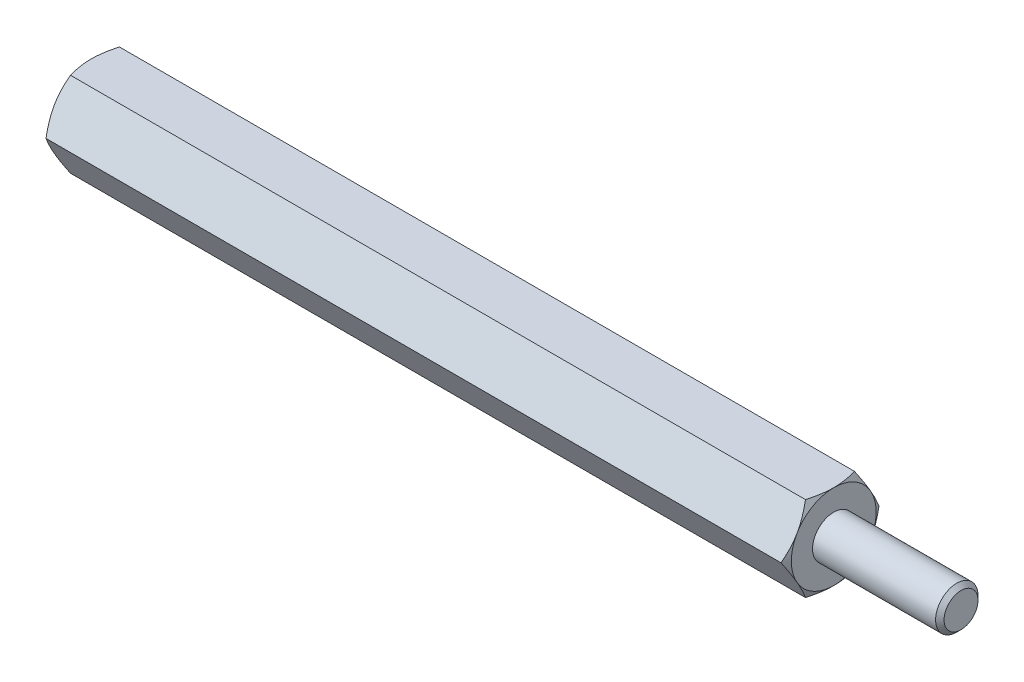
SolidWorks part; units mm, degrees
ref_plane "Front Plane" through (0, 0, 0) normal (0, 0, 1) x (1, 0, 0)
ref_plane "Top Plane" through (0, 0, 0) normal (0, 1, 0) x (1, 0, 0)
ref_plane "Right Plane" through (0, 0, 0) normal (1, 0, 0) x (0, 0, -1)
sketch "Sketch1" plane through (0, 0, 0) normal (1, 0, 0) x (0, 0, -1)
  line L1 (1.1547, 2) -> (-1.1547, 2)
  line L2 (-1.1547, 2) -> (-2.3094, 0)
  line L3 (-2.3094, 0) -> (-1.1547, -2)
  line L4 (-1.1547, -2) -> (1.1547, -2)
  line L5 (1.1547, -2) -> (2.3094, 0)
  line L6 (2.3094, 0) -> (1.1547, 2)
  circle A0 centre (0, 0) radius 2 construction
  dimension "D1" = 4
extrude "Extrude2" add sketch "Sketch1" along normal mid plane 35
sketch "Sketch2" plane through (0, 0, 0) normal (0, 0, 1) x (1, 0, 0)
  line L0 (-17.5, 2) -> (-16, 4.5981)
  line L1 (-17.5, 5) -> (-17.5, 2)
  line L3 (0, 0) -> (50000, 0) construction
  arc A0 (-16, 4.5981) -> (-17.5, 5) centre (-16.6962, 5) ccw
  dimension "D1" = 30
  dimension "D2" = 3
revolve "Cut-Revolve1" cut sketch "Sketch2" angle 360 about L3
mirror "Mirror1" about plane through (0, 0, 0) normal (1, 0, 0) of "Cut-Revolve1"
sketch "Sketch3" plane through (-17.5, 0, 0) normal (-1, 0, 0) x (0, 0, 1)
  circle A0 centre (0, 0) radius 0.8
  dimension "D1" = 1.6
extrude "Extrude3" cut sketch "Sketch3" against normal blind 6
sketch "Sketch4" plane through (0, 0, 0) normal (0, 0, 1) x (1, 0, 0)
  line L0 (-11.5, 0) -> (-11.5, 0.8)
  line L1 (17.3214, 0) -> (-17.3214, 0) construction
  line L2 (-11.5, 0.8) -> (-11.0381, 0)
  line L3 (-11.0381, 0) -> (-11.5, 0)
  line L4 (-17.5, 1) -> (-17.5, -1) construction
  point P4 (-17.5, 0)
  dimension "D1" = 30
  dimension "D2" = 0.8
  dimension "D3" = 6
revolve "Cut-Revolve2" cut sketch "Sketch4" angle 360 about L3
sketch "Sketch5" plane through (17.5, 0, 0) normal (1, 0, 0) x (0, 0, -1)
  circle A0 centre (0, 0) radius 1
  dimension "D1" = 2
extrude "Extrude4" add sketch "Sketch5" along normal blind 6
chamfer "Chamfer1" distance 0.2 angle 45 1 edges at (23.5, 0, -1)
equation "\"D2@Sketch4\" = \"D1@Sketch3\"/2"
